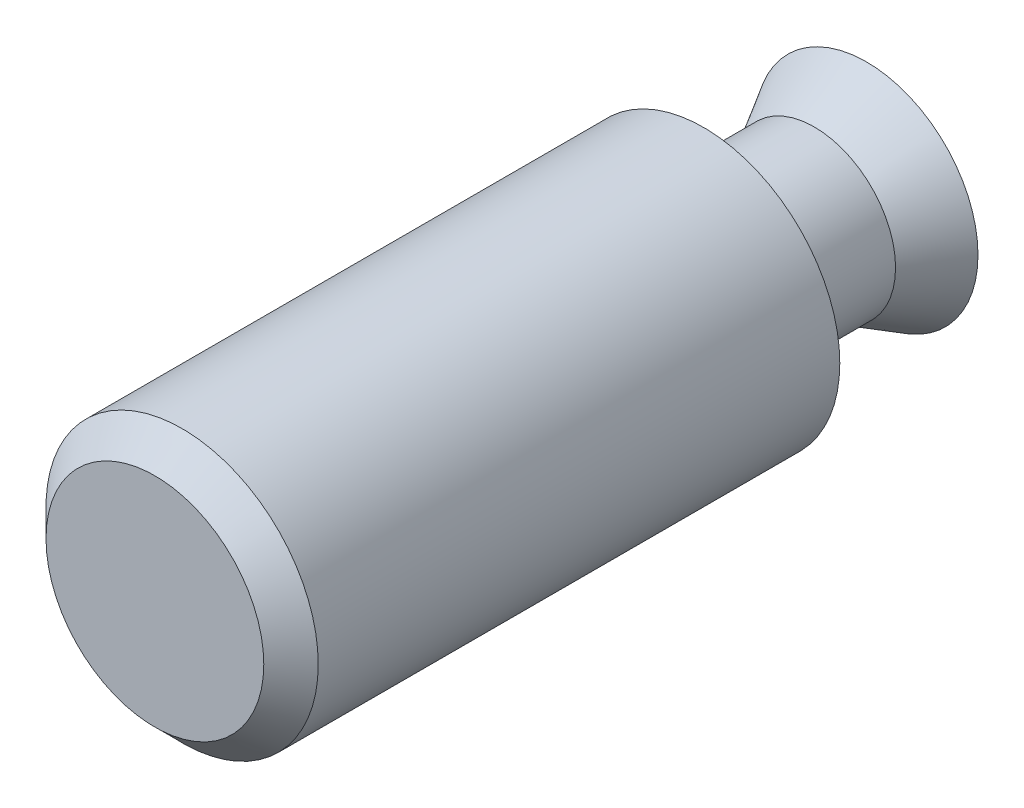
SolidWorks part; units mm, degrees
ref_plane "Спереди" through (0, 0, 0) normal (0, 0, 1) x (1, 0, 0)
ref_plane "Сверху" through (0, 0, 0) normal (0, 1, 0) x (1, 0, 0)
ref_plane "Справа" through (0, 0, 0) normal (1, 0, 0) x (0, 0, -1)
sketch "Эскиз1" plane through (0, 0, 0) normal (1, 0, 0) x (0, 0, -1)
  line L0 (0, 0) -> (42.6269, 0) construction
  line L1 (0, 0) -> (0, 3.175)
  line L2 (0.7937, 3.9688) -> (16.002, 3.9688)
  line L3 (16.002, 3.9688) -> (16.002, 2.3685)
  line L4 (16.002, 2.3685) -> (19.2278, 2.3685)
  line L5 (19.2278, 2.3685) -> (20.7518, 3.2484)
  line L6 (20.7518, 3.2484) -> (20.7518, 0)
  line L7 (20.7518, 0) -> (0, 0)
  line L8 (0, 3.175) -> (0.7937, 3.9688)
  point P4 (0, 3.9688)
  dimension "D1" = 30
  dimension "D2" = 1.524
  dimension "D3" = 4.7498
  dimension "D4" = 16.002
  dimension "D5" = 7.9375
  dimension "D6" = 4.7371
revolve "Повернуть1" add sketch "Эскиз1" angle 360 about L0
